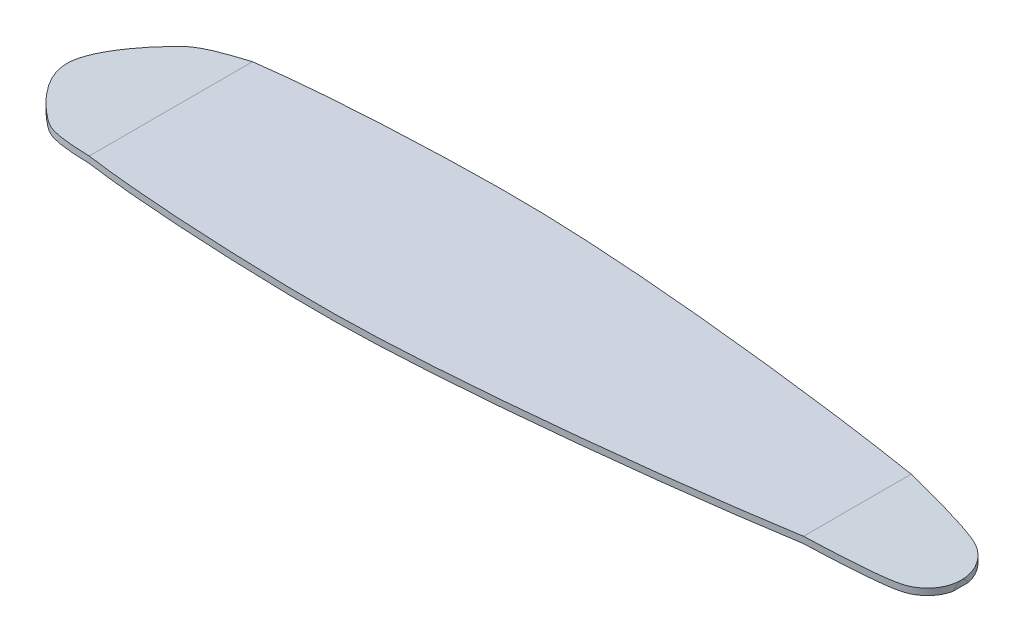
SolidWorks part; units mm, degrees
ref_plane "Front" through (0, 0, 0) normal (0, 0, 1) x (1, 0, 0)
ref_plane "Top" through (0, 0, 0) normal (0, 1, 0) x (1, 0, 0)
ref_plane "Right" through (0, 0, 0) normal (1, 0, 0) x (0, 0, -1)
sketch "Esquisse1" plane through (0, 0, 0) normal (0, 0, 1) x (1, 0, 0)
  line L0 (-429.6857, 0) -> (-429.6857, 244.2353) construction
  line L1 (-966.7988, 0) -> (107.4274, 0)
  line L2 (107.4274, 0) -> (270.3143, -20)
  line L3 (20.3143, 63.3484) -> (20.3143, 104.7682) construction
  line L4 (-966.7988, 0) -> (-1129.6857, -20)
  dimension "D1" = 1400
  dimension "D2" = 450
  dimension "D3" = 173
  dimension "D4" = 20
extrude "Extru.-Mince1" add sketch "Esquisse1" along normal mid plane 300 thin
sketch "Esquisse2" plane through (0, -10, 0) normal (0, -1, 0) x (1, 0, 0)
  line L0 (-1129.6857, 0) -> (270.3143, 0) construction
  line L1 (-1129.6857, 150) -> (-1129.6857, -150) construction
  line L2 (270.3143, 150) -> (270.3143, -150) construction
  line L3 (106.8157, 150) -> (-966.1872, 150) construction
  line L4 (-1129.6857, 15.7063) -> (-1129.6857, -15.7063) construction
  line L5 (270.3143, -18.8903) -> (270.3143, 18.8903) construction
  line L6 (-311.5759, 150) -> (-765.4266, 150) construction
  line L7 (-966.1872, 150) -> (-1128.467, 150) construction
  line L8 (-1510.6011, 407.162) -> (622.0895, 407.162)
  line L9 (-1510.6011, 407.162) -> (-1510.6011, -407.162)
  line L10 (-1510.6011, -407.162) -> (622.0895, -407.162)
  line L11 (622.0895, 407.162) -> (622.0895, -407.162)
  line L12 (-1510.6011, 407.162) -> (622.0895, -407.162) construction
  line L13 (-1510.6011, -407.162) -> (622.0895, 407.162) construction
  line L14 (-1128.467, 150) -> (-1128.467, -150) construction
  line L15 (269.0956, 150) -> (269.0956, -150) construction
  line L16 (269.0956, 150) -> (106.8157, 150) construction
  spline S0 degree 3 poles (-1129.6857, 0) (-1129.6857, 34.8885) (-1082.1968, 83.4901) (-1014.8354, 132.368) (-706.1124, 151.1848) (-334.8066, 148.7057) (192.7169, 79.3756) (262.2262, 42.2227) (270.3143, 15.3479) (270.3143, 0) knots 0 0 0 0 0.162221 0.202465 0.380223 0.442272 0.760907 0.820663 1 1 1 1
  spline S1 degree 3 poles (-1129.6857, 0) (-1129.6857, -34.8885) (-1082.1968, -83.4901) (-1014.8354, -132.368) (-706.1124, -151.1848) (-334.8066, -148.7057) (192.7169, -79.3756) (262.2262, -42.2227) (270.3143, -15.3479) (270.3143, 0) knots 0 0 0 0 0.162221 0.202465 0.380223 0.442272 0.760907 0.820663 1 1 1 1
  point P24 (-444.2558, 0)
  dimension "D1" = 44.0696
  dimension "D2" = 78
  dimension "D3" = 542
  dimension "D4" = 30
  dimension "D5" = 96
extrude "Enlèv. mat.-Extru.1" cut sketch "Esquisse2" against normal through all both and the other way through all
sketch "Esquisse3" plane through (0, -10, 0) normal (0, -1, 0) x (1, 0, 0)
  spline S0 degree 3 poles (-867.3533, -50.6592) (-564.7342, 181.5488) (-281.6367, -166.0349) (27.4865, -16.4815) knots 0 0 0 0 1 1 1 1 construction
  text T0 "Longboard" font "Century Gothic" height 50
  point P4 (-259.0456, -43.3439)
  point P6 (27.4865, -16.4815)
  point P7 (-822.2602, -48.7164)
  point P8 (-867.3533, -50.6592)
extrude "Enlèv. mat.-Extru.2" cut sketch "Esquisse3" against normal blind 0.1
